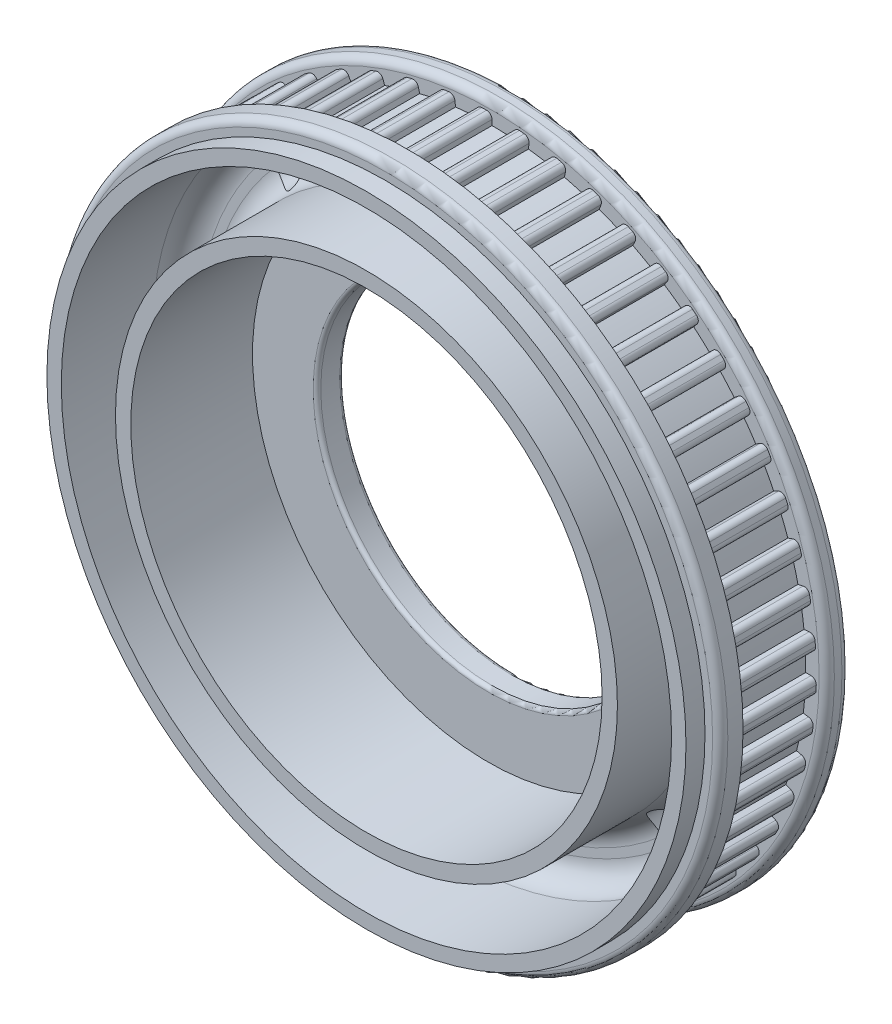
SolidWorks part; units mm, degrees
ref_plane "Plan de face" through (0, 0, 0) normal (0, 0, 1) x (1, 0, 0)
ref_plane "Plan de dessus" through (0, 0, 0) normal (0, 1, 0) x (1, 0, 0)
ref_plane "Plan de droite" through (0, 0, 0) normal (1, 0, 0) x (0, 0, -1)
sketch "Esquisse5" plane through (0, 0, 0) normal (0, 0, 1) x (1, 0, 0)
  circle A0 centre (0, 0) radius 44
  dimension "D1" = 88
extrude "Boss.-Extru.6" add sketch "Esquisse5" along normal blind 3
sketch "Esquisse6" plane through (0, 0, 3) normal (0, 0, 1) x (1, 0, 0)
  line L0 (0, 0) -> (0, 67.4545) construction
  line L1 (0, 0) -> (-2.7541, 56.7175) construction
  line L2 (-2, 41.1876) -> (-2.0679, 42.586)
  line L3 (0, 41.2362) -> (0, 42.6362)
  line L4 (-2, 41.1876) -> (0, 41.2362) construction
  arc A0 (-2, 41.1876) -> (0, 41.2362) centre (0, 0) cw
  arc A1 (0, 42.6362) -> (-2.0679, 42.586) centre (0, 0) ccw
  dimension "D1" = 2.78
  dimension "D2" = 2
  dimension "D3" = 1.4
extrude "Boss.-Extru.7" add sketch "Esquisse6" along normal blind 11
sketch "Esquisse7" plane through (0, 0, 3) normal (0, 0, 1) x (1, 0, 0)
  circle A0 centre (0, 0) radius 41.2362
extrude "Boss.-Extru.8" add sketch "Esquisse7" along normal blind 11
sketch "Esquisse8" plane through (0, 0, 14) normal (0, 0, 1) x (1, 0, 0)
  circle A0 centre (0, 0) radius 44
  dimension "D1" = 88
fillet "Congé1" radius 0.7 2 edges at (-2.0679, 42.586, 8.5) (0, 42.6362, 8.5)
sketch "Esquisse9" plane through (0, 0, 14) normal (0, 0, 1) x (1, 0, 0)
  circle A0 centre (0, 0) radius 44
  dimension "D1" = 88
extrude "Boss.-Extru.9" add sketch "Esquisse9" along normal blind 3
sketch "Esquisse10" plane through (0, 0, 17) normal (0, 0, 1) x (1, 0, 0)
  circle A0 centre (0, 0) radius 42
  dimension "D1" = 84
extrude "Boss.-Extru.10" add sketch "Esquisse10" along normal blind 2.5
sketch "Esquisse11" plane through (0, 0, 19.5) normal (0, 0, 1) x (1, 0, 0)
  circle A0 centre (0, 0) radius 30.975
  dimension "D1" = 61.95
extrude "Enlèv. mat.-Extru.2" cut sketch "Esquisse11" against normal blind 16
sketch "Esquisse12" plane through (0, 0, 0) normal (0, 0, -1) x (-1, 0, 0)
  circle A0 centre (0, 0) radius 22.5
  dimension "D1" = 45
extrude "Enlèv. mat.-Extru.3" cut sketch "Esquisse12" against normal through all
fillet "Congé3" radius 1 3 edges at (44, 0, 17) (44, 0, 3) (44, 0, 0)
sketch "Esquisse13" plane through (0, 0, 0) normal (0, 0, -1) x (-1, 0, 0)
  line L0 (0, 0) -> (0, 48.2084) construction
  circle A0 centre (0, 35.5) radius 2.15
  dimension "D2" = 4.3
  dimension "D1" = 35.5
extrude "Enlèv. mat.-Extru.4" cut sketch "Esquisse13" against normal through all
chamfer "Chanfrein2" distance 3 angle 45 1 edges at (-2.15, 35.5, 0)
pattern_circular "Répétition circulaire2" count 8 over 360 about axis through (0, 0, 0) along (0, 0, 1) of "Enlèv. mat.-Extru.4", "Chanfrein2"
fillet "Congé4" radius 0.5 2 edges at (-22.5, 0, 0) (22.5, 0, 3.5)
pattern_circular "Répétition circulaire3" count 54 over 360 about axis through (0, 0, 0) along (0, 0, 1) of "Boss.-Extru.7", "Congé1"
sketch "Esquisse14" plane through (0, 0, 19.5) normal (0, 0, 1) x (1, 0, 0)
  circle A0 centre (0, 0) radius 32.9882
  circle A1 centre (0, 0) radius 40.1076
extrude "Enlèv. mat.-Extru.5" cut sketch "Esquisse14" against normal blind 15
fillet "Congé5" radius 3 1 edges at (32.9882, 0, 4.5)
fillet "Congé6" radius 3 1 edges at (40.1076, 0, 4.5)
